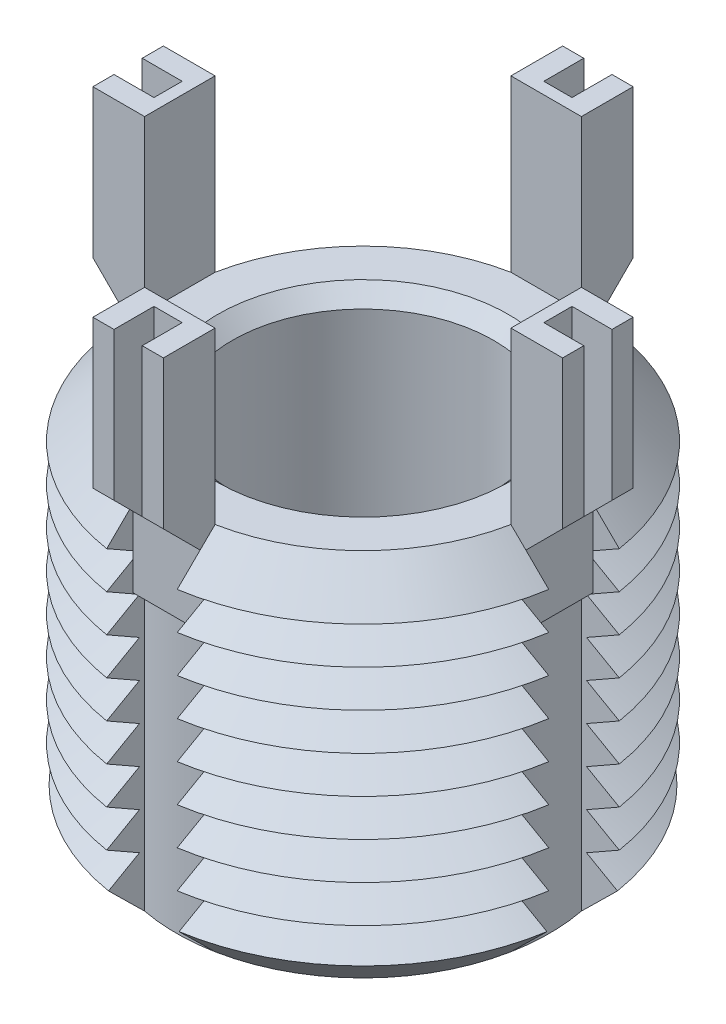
SolidWorks part; units mm, degrees
ref_plane "Front Plane" through (0, 0, 0) normal (0, 0, 1) x (1, 0, 0)
ref_plane "Top Plane" through (0, 0, 0) normal (0, 1, 0) x (1, 0, 0)
ref_plane "Right Plane" through (0, 0, 0) normal (1, 0, 0) x (0, 0, -1)
sketch "Sketch1" plane through (0, 0, 0) normal (0, 1, 0) x (1, 0, 0)
  circle A0 centre (0, 0) radius 9.525
  dimension "D1" = 19.05
extrude "Boss-Extrude1" add sketch "Sketch1" against normal blind 15.748
chamfer "Chamfer1" distance 1.587 angle 45 2 edges at (0, -15.748, 9.525) (0, 0, 9.525)
sketch "Sketch2" plane through (0, 0, 0) normal (1, 0, 0) x (0, 0, -1)
  line L0 (0, 0.8859) -> (0, -9.2617) construction
sketch "Sketch3" plane through (0, 0, 0) normal (1, 0, 0) x (0, 0, -1)
  line L0 (-9.525, -1.587) -> (-8.1506, -2.3805)
  line L1 (-8.1506, -2.3805) -> (-9.525, -3.174)
  line L2 (-9.525, -1.587) -> (-9.525, -14.161) construction
  line L3 (-9.525, -3.174) -> (-9.525, -1.587)
  dimension "D1" = 1.587
revolve "Cut-Revolve1" cut sketch "Sketch3" angle 360 about L0
pattern_linear "LPattern1" count 8 spacing 1.587 along (0, -1, 0) of "Cut-Revolve1"
sketch "Sketch4" plane through (0, 0, 0) normal (0, 1, 0) x (1, 0, 0)
  line L0 (-7.795, 1.5) -> (-9.4061, 1.5)
  line L2 (-9.4061, -1.5) -> (-7.795, -1.5)
  arc A0 (-7.795, 1.5) -> (-7.795, -1.5) centre (0, 0) ccw
  arc A1 (-9.4061, 1.5) -> (-9.4061, -1.5) centre (0, 0) ccw
  circle A2 centre (0, 0) radius 9.525 construction
  circle A3 centre (0, 0) radius 7.938 construction
  point P1 (-7.938, 0)
  point P3 (-9.525, 0)
  point P13 (0, 0)
  dimension "D1" = 3
extrude "Cut-Extrude1" cut sketch "Sketch4" against normal up to surface (15.748 mm away)
pattern_circular "CirPattern1" count 4 over 360 about axis through (0, 0, 0) along (0, 1, 0) of "Cut-Extrude1"
sketch "Sketch5" plane through (0, 0, 0) normal (1, 0, 0) x (0, 0, -1)
  line L0 (-7.795, 7.239) -> (-7.795, -3.761)
  line L1 (-7.795, -3.761) -> (-8.295, -3.761)
  line L2 (-8.295, -3.761) -> (-8.295, -0.761)
  line L3 (-8.295, -0.761) -> (-9.995, 0.939)
  line L4 (-9.995, 0.939) -> (-9.995, 7.239)
  line L5 (-9.995, 7.239) -> (-7.795, 7.239)
  line L6 (-9.4061, -4.761) -> (-1.5, -4.761) construction
  point P9 (-1.5, 0)
  point P10 (-8.295, -0.761)
  dimension "D1" = 1
  dimension "D2" = 11
  dimension "D3" = 8
  dimension "D4" = 2.2
  dimension "D5" = 0.5
  dimension "D6" = 45
extrude "Boss-Extrude3" add sketch "Sketch5" along normal mid plane 3
pattern_circular "CirPattern2" count 4 over 360 about axis through (0, 0, 0) along (0, 1, 0) of "Boss-Extrude3"
sketch "Sketch6" plane through (0, 7.239, 0) normal (0, 1, 0) x (1, 0, 0)
  line L0 (-9.995, -1.5) -> (-9.995, 1.5) construction
  line L1 (-9.995, -0.6) -> (-8.295, -0.6)
  line L2 (-9.995, -0.6) -> (-9.995, 0.6)
  line L3 (-9.995, 0.6) -> (-8.295, 0.6)
  line L4 (-8.295, -0.6) -> (-8.295, 0.6)
  line L5 (-9.995, -0.6) -> (-8.295, 0.6) construction
  line L6 (-9.995, 0.6) -> (-8.295, -0.6) construction
  line L7 (9.995, 1.5) -> (9.995, -1.5) construction
  line L8 (-0.6, 8.295) -> (0.6, 8.295)
  line L9 (-0.6, 8.295) -> (-0.6, 9.995)
  line L10 (-0.6, 9.995) -> (0.6, 9.995)
  line L11 (0.6, 8.295) -> (0.6, 9.995)
  line L12 (-0.6, 8.295) -> (0.6, 9.995) construction
  line L13 (-0.6, 9.995) -> (0.6, 8.295) construction
  line L14 (8.295, -0.6) -> (9.995, -0.6)
  line L15 (8.295, -0.6) -> (8.295, 0.6)
  line L16 (8.295, 0.6) -> (9.995, 0.6)
  line L17 (9.995, -0.6) -> (9.995, 0.6)
  line L18 (8.295, -0.6) -> (9.995, 0.6) construction
  line L19 (8.295, 0.6) -> (9.995, -0.6) construction
  line L20 (-0.6, -9.995) -> (0.6, -9.995)
  line L21 (-0.6, -9.995) -> (-0.6, -8.295)
  line L22 (-0.6, -8.295) -> (0.6, -8.295)
  line L23 (0.6, -9.995) -> (0.6, -8.295)
  line L24 (-0.6, -9.995) -> (0.6, -8.295) construction
  line L25 (-0.6, -8.295) -> (0.6, -9.995) construction
  line L26 (-1.5, 9.995) -> (1.5, 9.995) construction
  line L27 (1.5, -9.995) -> (-1.5, -9.995) construction
  point P0 (-9.145, 0)
  point P7 (-9.995, 0)
  point P8 (-9.995, 0)
  point P9 (0, 9.145)
  point P14 (9.145, 0)
  point P19 (0, -9.145)
  point P24 (0, 9.995)
  point P25 (9.995, 0)
  point P26 (9.995, 0)
  point P27 (0, 9.995)
  point P30 (0, -9.995)
  point P33 (0, -9.995)
  dimension "D1" = 1.2
  dimension "D2" = 1.7
extrude "Cut-Extrude3" cut sketch "Sketch6" against normal through all both and the other way through all
sketch "Sketch7" plane through (0, 0, 0) normal (0, 1, 0) x (1, 0, 0)
  circle A0 centre (0, 0) radius 5.556
  dimension "D1" = 11.112
extrude "Cut-Extrude4" cut sketch "Sketch7" against normal up to surface (15.748 mm away)
chamfer "Chamfer2" distance 0.635 angle 45 2 edges at (0, 0, 5.556) (0, -15.748, 5.556)
